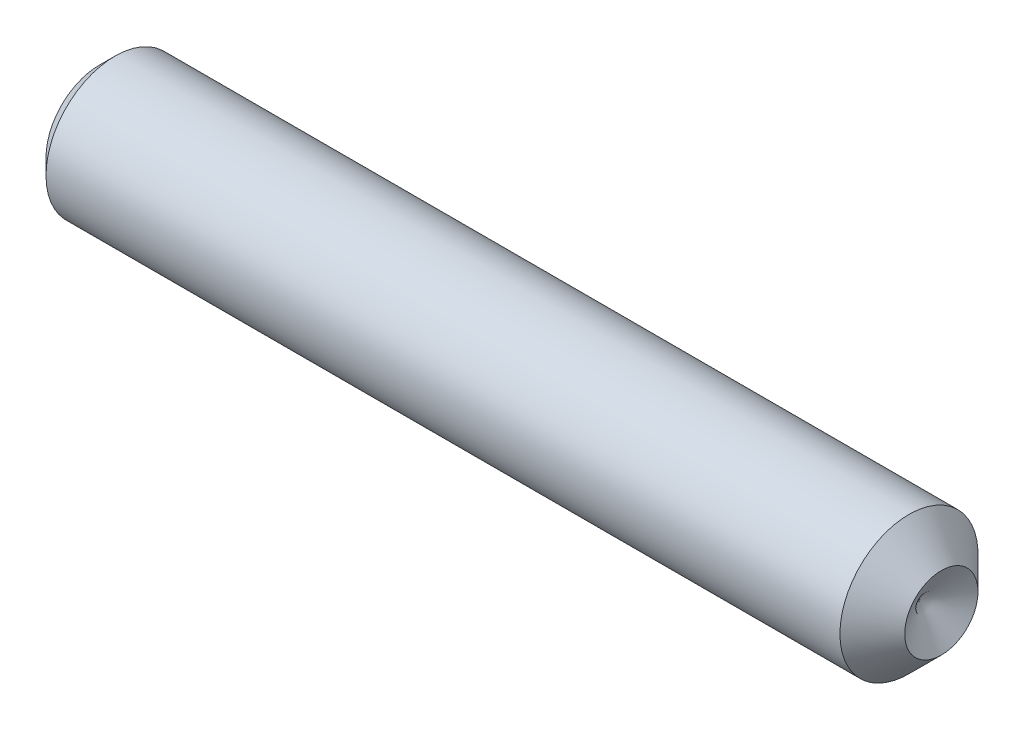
SolidWorks part; units mm, degrees
revolve "BaseBody" add sketch "BodySke" angle 360 about L5
sketch "BodySke" plane through (0, 0, 0) normal (0, 0, 1) x (1, 0, 0)
  line L0 (0, 0) -> (0, 1.6104)
  line L1 (0, 1.6104) -> (0.4724, 2.0828)
  line L2 (0.4724, 2.0828) -> (24.4221, 2.0828)
  line L3 (24.4221, 2.0828) -> (25.4, 1.1049)
  line L4 (24.7361, 0) -> (0, 0)
  line L5 (-12.7, 0) -> (88.9, 0) construction
  line L6 (24.7361, 0) -> (25.4, 1.1049)
  line L7 (25.4, 1.1049) -> (25.4, 10.6299) construction
  line L8 (0, -1.6104) -> (0.4724, -2.0828) construction
  line L9 (24.7361, 0) -> (25.4, -1.1049) construction
  line L10 (24.4221, -2.0828) -> (25.4, -1.1049) construction
  line L11 (0.7925, 15.875) -> (0.7925, -3.175) construction
ref_plane "Plane1" through (0, 0, 0) normal (0, 0, 1) x (1, 0, 0)
ref_plane "Plane2" through (0, 0, 0) normal (0, 1, 0) x (1, 0, 0)
ref_plane "Plane3" through (0, 0, 0) normal (1, 0, 0) x (0, 0, -1)
sketch "Sketch2" plane through (0, 0, 0) normal (-1, 0, 0) x (0, 0, 1)
  line L0 (0.5719, 0.9906) -> (-0.5719, 0.9906)
  line L1 (-0.5719, 0.9906) -> (-1.1438, 0)
  line L2 (0.5719, 0.9906) -> (1.1438, 0)
  line L3 (0.5719, -0.9906) -> (1.1438, 0)
  line L4 (0.5719, -0.9906) -> (-0.5719, -0.9906)
  line L5 (-0.5719, -0.9906) -> (-1.1438, 0)
extrude "Hex" cut sketch "Sketch2" against normal blind 2.286
sketch "Sketch4" plane through (0, 4.7709, -0.5249) normal (-1, 0, 0) x (0, 0, 1)
  line L0 (0.5249, -4.7709) -> (1.7695, -4.7709)
  line L1 (0.5249, -4.7709) -> (6.6732, -1.2211) construction
  line L2 (0.5249, -4.7709) -> (1.1472, -3.693)
  line L3 (1.5334, -4.5112) -> (1.7149, -4.4064)
  line L4 (1.254, -4.0273) -> (1.4355, -3.9225)
  arc A0 (1.5334, -4.5112) -> (1.254, -4.0273) centre (0.5249, -4.7709) ccw
  arc A1 (1.7695, -4.7709) -> (1.7149, -4.4064) centre (0.5249, -4.7709) ccw
  arc A2 (1.1472, -3.693) -> (1.4355, -3.9225) centre (0.5249, -4.7709) cw
  circle A3 centre (0.5249, -4.7709) radius 1.0414 construction
  circle A4 centre (0.5249, -4.7709) radius 1.2446 construction
extrude "Spline" [suppressed] cut sketch "Sketch4" against normal blind 2.032
pattern_circular "CirPattern1" [suppressed] count 6 every 60 about axis through (-12.7, 0, 0) along (1, 0, 0)
sketch "ThdSchSke" plane through (0, 0, 0) normal (0, 0, 1) x (1, 0, 0)
  line L0 (0.4724, -1.6104) -> (0.1416, -2.0828)
  line L1 (0.4724, -1.6104) -> (0.8032, -2.0828)
  line L2 (0.8032, -2.0828) -> (0.8032, -2.6035)
  line L3 (-3.175, 0) -> (5.1513, 0) construction
  line L4 (0.4724, 2.0828) -> (0.4724, -2.0828) construction
  line L5 (0.8032, -2.6035) -> (0.1416, -2.6035)
  line L6 (0.1416, -2.6035) -> (0.1416, -2.0828)
revolve "ThreadSchematic" [suppressed] cut sketch "ThdSchSke" angle 360 about L3
pattern_linear "ThdSchPat" [suppressed]
equation "\"D2@Sketch2\" = \"Hex_size@Sketch2\" / 2"
equation "\"D3@Sketch2\" = \"Hex_size@Sketch2\" / 2"
equation "\"Thread_minor@ThreadCosmetic\" = \"Minor_dia@BodySke\""
equation "\"D1@Sketch4\" = \"Spline_a_dim@Sketch4\" / 2"
equation "\"D3@Sketch4\" = \"Spline_p_dim@Sketch4\" / 2"
equation "\"D2@CirPattern1\" = \"Spline_a_dim@Sketch4\""
equation "\"Num_teeth@CirPattern1\" = 360 / \"D2@CirPattern1\""
equation "\"Thread_minor@ThdSchSke\" = \"Thread_minor@ThreadCosmetic\""
equation "\"Diameter@ThdSchSke\" = \"Diameter@BodySke\""
equation "\"Overcut@ThdSchSke\" = \"Diameter@BodySke\" * 1.25"
equation "\"Num_threads@ThdSchPat\" = int( (\"Length@BodySke\" - ( ( ( \"Diameter@BodySke\" - \"Minor_dia@BodySke\" ) * 0.5 ) / tan( \"Drive_ch_ang@BodySke\" * 0.017453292 ) ) - ( ( ( \"Diameter@BodySke\" - \"Cup_dia@BodySk"
equation "\"Advance@ThdSchPat\" = (\"Length@BodySke\" - ( ( ( \"Diameter@BodySke\" - \"Minor_dia@BodySke\" ) * 0.5 ) / tan( \"Drive_ch_ang@BodySke\" * 0.017453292 ) ) - ( ( ( \"Diameter@BodySke\" - \"Cup_dia@BodySke\" ) * 0."
equation "' \"Num_threads@ThdSchPat\" = \"Num_threads@ThdSchPat\" - sgn( \"Num_threads@ThdSchPat\" - 1) '---chamfered tips only---"
